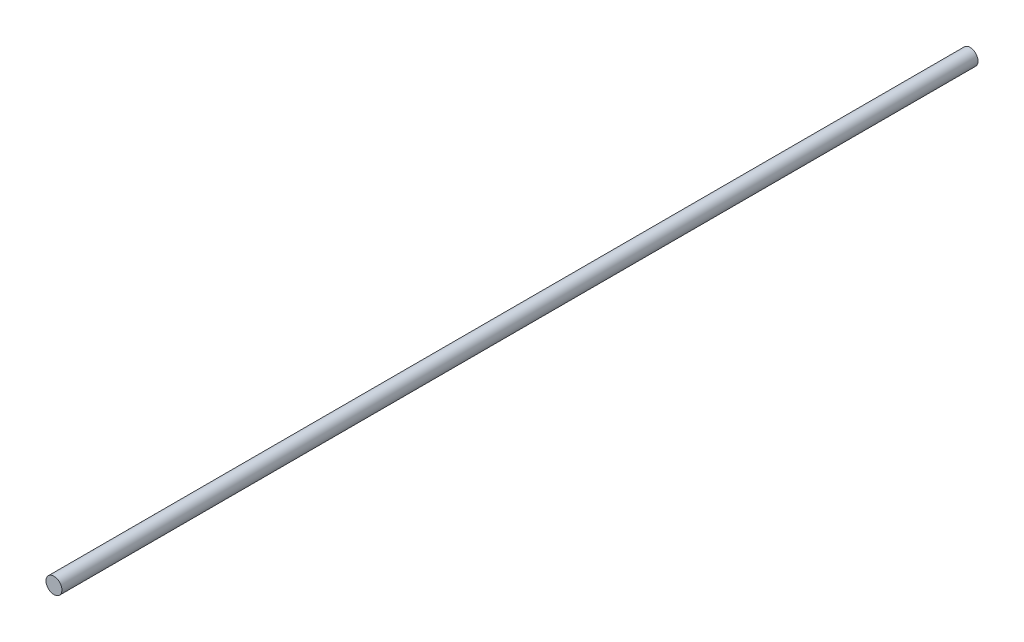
SolidWorks part; units mm, degrees
ref_plane "Front Plane" through (0, 0, 0) normal (0, 0, 1) x (1, 0, 0)
ref_plane "Top Plane" through (0, 0, 0) normal (0, 1, 0) x (1, 0, 0)
ref_plane "Right Plane" through (0, 0, 0) normal (1, 0, 0) x (0, 0, -1)
sketch "Sketch1" plane through (0, 0, 0) normal (0, 0, 1) x (1, 0, 0)
  circle A0 centre (0, 0) radius 30
  dimension "D1" = 60
extrude "Boss-Extrude1" add sketch "Sketch1" against normal blind 3450
